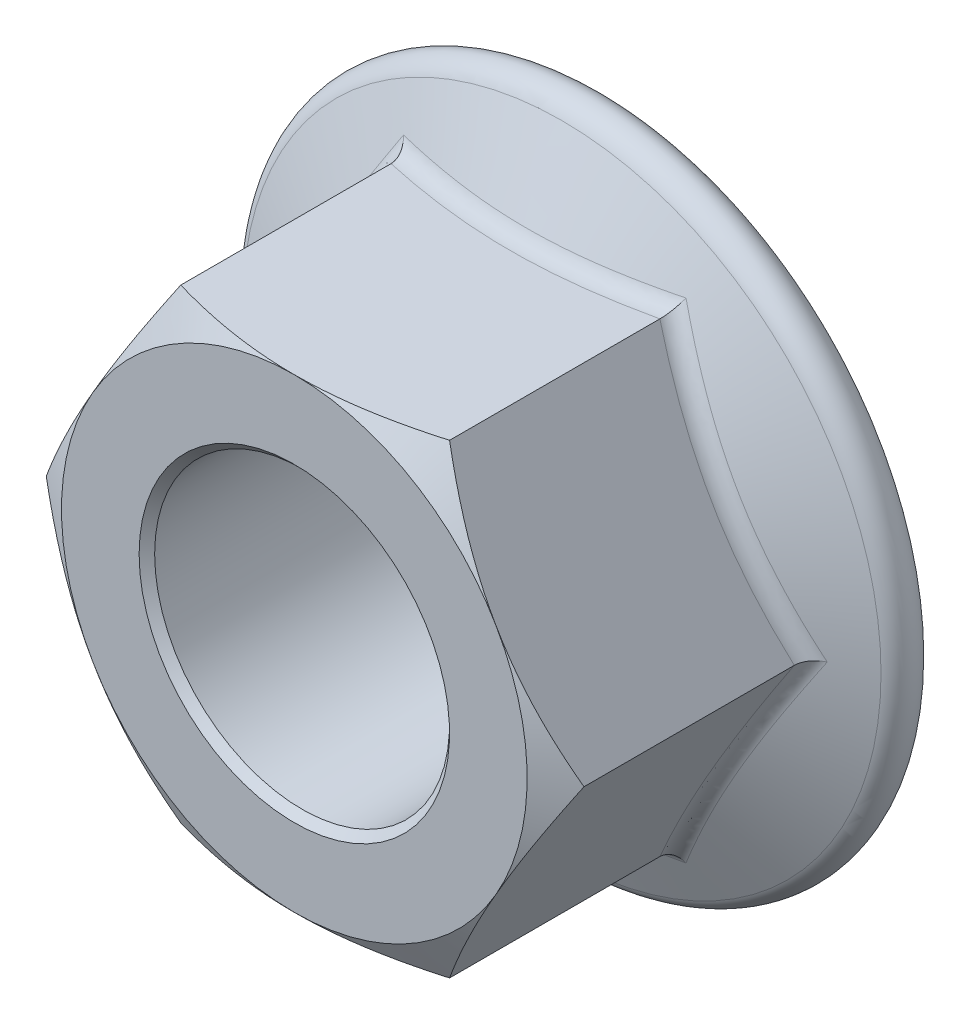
SolidWorks part; units mm, degrees
ref_plane "Front" through (0, 0, 0) normal (0, 0, 1) x (1, 0, 0)
ref_plane "Top" through (0, 0, 0) normal (0, 1, 0) x (1, 0, 0)
ref_plane "Right" through (0, 0, 0) normal (1, 0, 0) x (0, 0, -1)
sketch "Sketch1" plane through (0, 0, 0) normal (0, 0, 1) x (1, 0, 0)
  line L1 (8.6603, -15) -> (17.3205, 0)
  line L2 (17.3205, 0) -> (8.6603, 15)
  line L3 (8.6603, 15) -> (-8.6603, 15)
  line L4 (-8.6603, 15) -> (-17.3205, 0)
  line L5 (-17.3205, 0) -> (-8.6603, -15)
  line L6 (-8.6603, -15) -> (8.6603, -15)
  circle A0 centre (0, 0) radius 15 construction
  circle A1 centre (0, 0) radius 9.5
  dimension "D1" = 19
  dimension "s" = 30
extrude "BaseNut" add sketch "Sketch1" against normal blind 20
sketch "Sketch3" plane through (0.6779, 0, -16.6426) normal (0, 1, 0) x (0, 0, -1)
  line L0 (4.0352, 0.6779) -> (-19.0613, 0.6779) construction
  line L2 (-16.6426, 15.6779) -> (-15.3029, 17.9984)
  line L4 (-15.3029, 17.9984) -> (-16.6426, 17.9984)
  line L5 (-16.6426, 17.9984) -> (-16.6426, 15.6779)
  line L6 (-6.6426, 17.9984) -> (-6.6426, 14.238) construction
  line L8 (3.3574, 17.9984) -> (3.3574, 15.6779)
  line L9 (2.0176, 17.9984) -> (3.3574, 17.9984)
  line L10 (3.3574, 15.6779) -> (2.0176, 17.9984)
  line L11 (3.3574, 17.9984) -> (-16.6426, 17.9984) construction
  dimension "D1" = 30
  dimension "sq" = 30
revolve "Double-Chamfer" cut sketch "Sketch3" angle 360 about L0
sketch "Sketch4" plane through (4.6827, 0, -16.7173) normal (0, 1, 0) x (0, 0, -1)
  line L0 (-21.7744, 4.6827) -> (9.7398, 4.6827) construction
  line L2 (-4.6401, 30.5008) -> (-4.6401, 8.9315) construction
  line L3 (0.5185, 25.2455) -> (-4.6401, 14.1827)
  line L4 (3.2827, 14.1827) -> (-16.7173, 14.1827) construction
  line L5 (3.2827, 14.1827) -> (3.2827, 24.6327)
  line L11 (-4.6401, 14.1827) -> (3.2827, 14.1827)
  arc A0 (3.2827, 24.6327) -> (0.5185, 25.2455) centre (1.8327, 24.6327) ccw
  dimension "m1" = 20
  dimension "dc" = 42.8
  dimension "dw" = 39.9
  dimension "&" = 25
revolve "Flange" add sketch "Sketch4" angle 360 about L0
fillet "FlangeFillet" radius 1.2 6 edges at (-10.9757, -10.9896, -14.8899) (-15.0051, 4.0104, -14.8899) (10.9757, 10.9896, -14.8899) (15.0051, -4.0104, -14.8899)
sketch "Sketch5" plane through (-5.1971, 0, -15.1971) normal (0, 1, 0) x (0, 0, -1)
  line L0 (3.5984, -5.1971) -> (-23.9926, -5.1971) construction
  line L1 (4.8029, 4.3029) -> (-15.1971, 4.3029) construction
  line L2 (-15.1971, 4.8029) -> (-15.1971, 4.3029)
  line L4 (-15.1971, 4.3029) -> (-14.6971, 4.3029)
  line L6 (-14.6971, 4.3029) -> (-15.1971, 4.8029)
  line L7 (-5.1971, 4.3029) -> (-5.1971, 0.9419) construction
  line L8 (4.3029, 4.3029) -> (4.8029, 4.8029)
  line L9 (4.8029, 4.3029) -> (4.3029, 4.3029)
  line L10 (4.8029, 4.8029) -> (4.8029, 4.3029)
  dimension "da" = 20
  dimension "D2" = 45
revolve "Hole" cut sketch "Sketch5" angle 360 about L0
sketch "Sketch6" plane through (0, 0, 0) normal (0, 1, 0) x (1, 0, 0)
  line L0 (-9.933, 0.5) -> (-9.5, 0.25)
  line L1 (-9.5, 0.25) -> (-9, 0.25)
  line L2 (-9, 0.25) -> (-9, 0.75)
  line L3 (-9, 0.75) -> (-9.5, 0.75)
  line L4 (-9.5, 0.75) -> (-9.933, 0.5)
  line L5 (0, 7.348) -> (0, 34.1252) construction
  dimension "D1" = 0.5
  dimension "D2" = 19
revolve "Cut-Revolve10" [suppressed] cut sketch "Sketch6" angle 360 about L5
pattern_linear "LPattern10" [suppressed] count 33 spacing 0.6 along (0, 0, -1)
equation "\"m1@Sketch4\" = \"m@BaseNut\""
equation "\"sq@Sketch3\" = \"s@Sketch1\""
equation "\"D2@Sketch6\"=\"D1@Sketch1\""
equation "\"D1@Sketch6\"= (\"D2@ThreadCosmetic1\"  - \"D2@Sketch6\" )  / 2"
equation "\"D3@LPattern10\"=\"D1@Sketch6\" * 1.2 "
equation "\"D1@LPattern10\"=\"m@BaseNut\"  / \"D3@LPattern10\""
